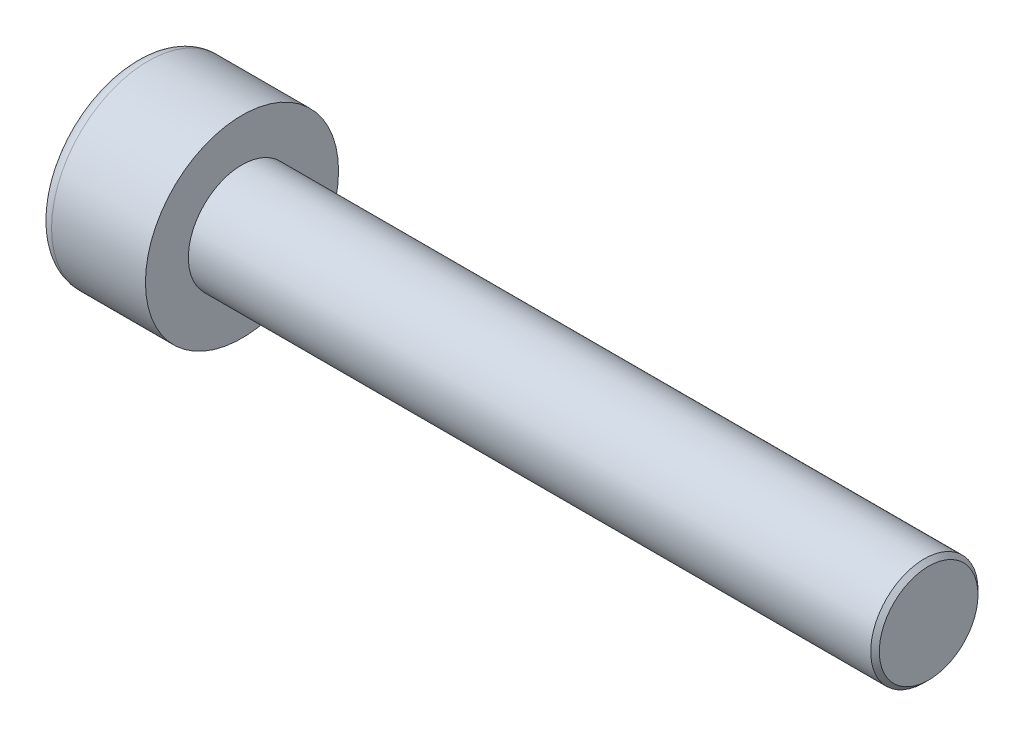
SolidWorks part; units mm, degrees
ref_plane "Front" through (0, 0, 0) normal (0, 0, 1) x (1, 0, 0)
ref_plane "Top" through (0, 0, 0) normal (0, 1, 0) x (1, 0, 0)
ref_plane "Right" through (0, 0, 0) normal (1, 0, 0) x (0, 0, -1)
other "Configuration Table"
sketch "Sketch1" plane through (0, 0, 0) normal (1, 0, 0) x (0, 0, -1)
  circle A0 centre (0, 0) radius 2.25
  dimension "dk" = 4.5
extrude "BaseHead" add sketch "Sketch1" along normal blind 2.5
sketch "Sketch2" plane through (2.5, 0, 0) normal (1, 0, 0) x (0, 0, -1)
  circle A0 centre (0, 0) radius 1.25
extrude "BaseBody" add sketch "Sketch2" along normal blind 16
sketch "Sketch3" plane through (0, 0, 0) normal (1, 0, 0) x (0, 0, -1)
  line L1 (1.1547, 0) -> (0.5774, 1)
  line L2 (0.5774, 1) -> (-0.5774, 1)
  line L3 (-0.5774, 1) -> (-1.1547, 0)
  line L4 (-1.1547, 0) -> (-0.5774, -1)
  line L5 (-0.5774, -1) -> (0.5774, -1)
  line L6 (0.5774, -1) -> (1.1547, 0)
  circle A0 centre (0, 0) radius 1 construction
  dimension "s" = 2
  dimension "e" = 2.3094
extrude "HexagonSocket" cut sketch "Sketch3" along normal blind 1.1
sketch "Sketch4" plane through (-4.1961, 0.75, 0) normal (0, 0, 1) x (-1, 0, 0)
  line L0 (-5.2961, 1.75) -> (-5.8735, 0.75)
  line L2 (-5.8735, 0.75) -> (-5.2961, 0.75)
  line L3 (-5.2961, 0.75) -> (-5.2961, 1.75)
  line L4 (-5.0351, 0.75) -> (0.839, 0.75) construction
  line L5 (-22.6961, 0.75) -> (-6.6961, 0.75) construction
  line L6 (-6.6961, 0.75) -> (-4.1961, 0.75) construction
  dimension "m" = 60
revolve "Cut-Revolve1" cut sketch "Sketch4" angle 360 about L4
fillet "HeadFillet" [suppressed] radius 0.1
fillet "TopFillet" radius 0.3125 1 edges at (0, 0, -2.25)
chamfer "Chamfer1" distance 0.1 angle 45 1 edges at (18.5, 0, -1.25)
sketch "Sketch5" plane through (0, 0, 0) normal (0, 0, 1) x (1, 0, 0)
  line L0 (18.4, 1.0391) -> (18.5218, 1.25)
  line L1 (18.5218, 1.25) -> (18.5218, 1.4935)
  line L2 (18.5218, 1.4935) -> (18.2783, 1.4935)
  line L3 (18.2783, 1.4935) -> (18.2783, 1.25)
  line L4 (18.2783, 1.25) -> (18.4, 1.0391)
  line L5 (0, 0) -> (7.8886, 0) construction
  line L6 (18.4, -1.25) -> (18.4, 1.25) construction
revolve "Cut-Revolve10" [suppressed] cut sketch "Sketch5" angle 360 about L5
pattern_linear "LPattern10" [suppressed] count 55 spacing 0.2922 along (1, 0, 0)
equation "\"r1@TopFillet\" = \"d@Sketch2\" / 8"
equation "\"D1@Chamfer1\" = \"r@HeadFillet\""
equation "\"D1@Sketch5\" = \"d@Sketch2\""
equation "\"D2@Sketch5\" =  ( \"d@Sketch2\" - \"D2@ThreadCosmetic1\" )  / 2"
equation "\"D3@LPattern10\" = \"D2@Sketch5\" * 1.2"
equation "\"D1@LPattern10\" = \"b@ThreadCosmetic1\" / \"D3@LPattern10\""
